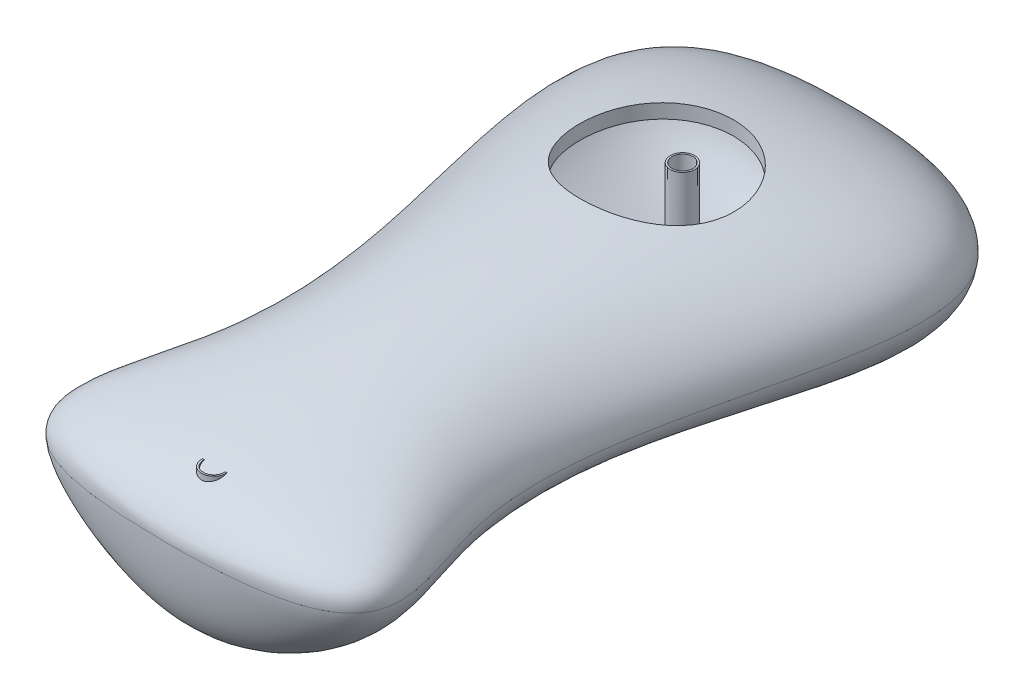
SolidWorks part; units mm, degrees
ref_plane "Front Plane" through (0, 0, 0) normal (0, 0, 1) x (1, 0, 0)
ref_plane "Top Plane" through (0, 0, 0) normal (0, 1, 0) x (1, 0, 0)
ref_plane "Right Plane" through (0, 0, 0) normal (1, 0, 0) x (0, 0, -1)
sketch "Sketch1" plane through (0, 0, 0) normal (0, 1, 0) x (1, 0, 0)
  line L0 (0, 50) -> (0, -50)
  line L1 (36.8015, 50) -> (-36.8015, 50) construction
  line L2 (-18.9468, -50) -> (18.9468, -50) construction
  spline S0 degree 3 poles (0, 50) (50, 50) (-2.35, -10.1614) (33.3333, -50) (0, -50) knots 0 0 0 0 0.707984 1 1 1 1
  spline S1 degree 3 poles (0, 50) (-50, 50) (2.35, -10.1614) (-33.3333, -50) (0, -50) knots 0 0 0 0 0.707984 1 1 1 1 construction
  point P2 (20, -25)
  dimension "D4" = 150
  dimension "D5" = 100
  dimension "D1" = 100
  dimension "D2" = 20
  dimension "D3" = 25
sketch "Sketch5" plane through (0, 0, 0) normal (1, 0, 0) x (0, 0, -1)
  line L2 (-50, 11.2955) -> (-50, -11.2955) construction
  line L3 (50, -16.7979) -> (50, 16.7979) construction
  line L4 (-50, 0) -> (50, 0)
  spline S0 degree 3 poles (-50, 0) (-50, 6.6667) (-1.4522, 15.8052) (50, 13.3333) (50, 0) knots 0 0 0 0 0.386889 1 1 1 1
  point P0 (-12, 12)
  dimension "D3" = 20
  dimension "D4" = 40
  dimension "D1" = 12
  dimension "D2" = 12
sketch "Sketch6" plane through (0, 0, 0) normal (0, 1, 0) x (1, 0, 0)
  line L0 (0, 50) -> (0, -50) construction
  line L1 (0, 50) -> (0, -50)
  spline S0 degree 3 poles (1866.9936, -665.9167) (-324.9794, 235.6) (169.979, -23.6194) (-135.3758, -98.083) (1961.0668, 341.6453) knots -1.270064 -1.270064 -1.270064 -1.270064 0.707984 1.745066 1.745066 1.745066 1.745066 only from (0, 50) to (0, -50) construction
  spline S1 degree 3 poles (0, 50) (-50, 50) (2.35, -10.1614) (-33.3333, -50) (0, -50) knots 0 0 0 0 0.707984 1 1 1 1
sketch "Sketch7" plane through (0, 0, 0) normal (1, 0, 0) x (0, 0, -1)
  line L0 (50, 16.9521) -> (50, -16.9521) construction
  line L1 (-50, -5.3831) -> (-50, 5.3831) construction
  line L2 (-50, 0) -> (50, 0)
  spline S0 degree 3 poles (-50, 0) (-50, -25) (-0.5394, 12.026) (50, -30) (50, 0) knots 0 0 0 0 0.402595 1 1 1 1
  point P0 (-10, -8)
  dimension "D3" = 75
  dimension "D4" = 90
  dimension "D1" = 10
  dimension "D2" = 8
other "Boundary12"
shell "Shell1" thickness 2
split "Split1" bodies to split 103 resulting bodies 105
split "Split4" trim tools "Top Plane" bodies to split 105 resulting bodies 108 109
sketch "Sketch8" plane through (0, 0, 0) normal (0, 1, 0) x (1, 0, 0)
  circle A0 centre (-10.3235, 34.1449) radius 1.5
  circle A1 centre (9.6765, 34.1449) radius 1.5
  circle A4 centre (-10.3235, 34.1449) radius 1.75
  circle A5 centre (9.6765, 34.1449) radius 1.75
  dimension "D5" = 3
  dimension "D6" = 3
  dimension "D7" = 20
  dimension "D18" = 3.5
  dimension "D19" = 3.5
extrude "Boss-Extrude2" add sketch "Sketch8" against normal blind 12
sketch "Sketch11" plane through (0, 0, 0) normal (0, 1, 0) x (1, 0, 0)
  circle A2 centre (9.6425, 6.2163) radius 1.5
  circle A3 centre (-10.3575, 6.2163) radius 1.5
  circle A6 centre (-10.3575, 6.2163) radius 1.75
  circle A7 centre (9.6425, 6.2163) radius 1.75
  dimension "D2" = 3
  dimension "D4" = 3.5
  dimension "D5" = 3.5
extrude "Boss-Extrude3" add sketch "Sketch11" against normal blind 7
sketch "Sketch13" plane through (0, 0, 0) normal (0, 1, 0) x (1, 0, 0)
  circle A8 centre (0, 20.1473) radius 11
  dimension "D8" = 22
extrude "Cut-Extrude1" cut sketch "Sketch13" along normal blind 24
split "Split5" trim tools "Top Plane" bodies to split 113 resulting bodies 114 115
sketch "Sketch14" plane through (0, 0, 0) normal (0, 1, 0) x (1, 0, 0)
  circle A0 centre (0, -43.3216) radius 1.75
  circle A1 centre (0, -43.3216) radius 1.75
  circle A2 centre (0, -43.3216) radius 1.5
  circle A3 centre (-19.2008, -67.0001) radius 1.75
  circle A4 centre (-19.2008, -67.0001) radius 1.75
  circle A5 centre (-19.2008, -67.0001) radius 1.5
  dimension "D1" = 3
  dimension "D2" = 3.5
  dimension "D3" = 3
extrude "Boss-Extrude6" add sketch "Sketch14" along normal blind 6.2 contours A0 | A2
sketch "Sketch18" plane through (0, 0, 0) normal (0, 1, 0) x (1, 0, 0)
  circle A0 centre (0, -41.3993) radius 1.25
  circle A1 centre (0, -41.3993) radius 1.75
  point P3 (0, 0)
  point P4 (0, 0)
  dimension "D1" = 3.5
  dimension "D2" = 2.5
extrude "Cut-Extrude2" cut sketch "Sketch18" against normal blind 23 contours A0
split "Split6" trim tools "Top Plane" bodies to split 127 resulting bodies 128 129
